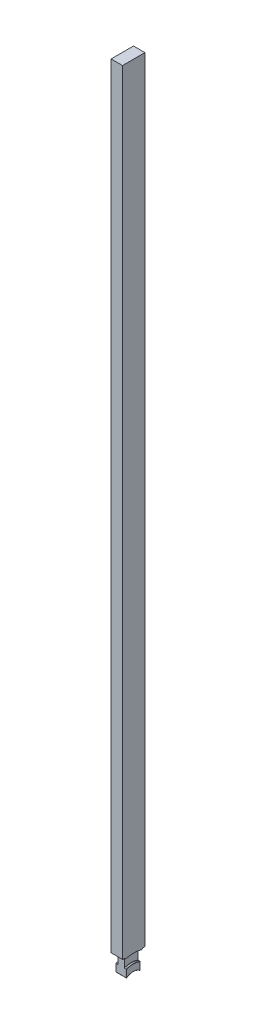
SolidWorks part; units mm, degrees
other "<4-48 DETENT>-<Imported1>"
other "<4-48 DETENT>-<Imported2>"
ref_plane "Front Plane" through (0, 0, 0) normal (0, 0, 1) x (1, 0, 0)
ref_plane "Top Plane" through (0, 0, 0) normal (0, 1, 0) x (1, 0, 0)
ref_plane "Right Plane" through (0, 0, 0) normal (1, 0, 0) x (0, 0, -1)
sketch "Sketch1" plane through (0, 0, 0) normal (1, 0, 0) x (0, 0, -1)
  line L0 (-6.477, 463.55) -> (-6.477, 0)
  line L1 (0, 249.2329) -> (0, 0) construction
  line L2 (6.477, 463.55) -> (6.477, 0)
  line L3 (-6.477, 463.55) -> (6.477, 463.55)
  line L4 (-6.477, 0) -> (6.477, 0)
  circle A1 centre (0, 0) radius 6.35 construction
  point P5 (0, 5.969)
  dimension "D1" = 6.35
  dimension "D2" = 457.2
  dimension "D3" = 12.954
  dimension "D4" = 0.381
extrude "Boss-Extrude1" add sketch "Sketch1" along normal mid plane 6.604
sketch "Sketch2" plane through (0, 0, 0) normal (0, 0, 1) x (1, 0, 0)
  line L0 (3.302, 10.3124) -> (1.905, 10.3124)
  line L1 (3.302, 463.55) -> (3.302, 0) construction
  line L2 (1.905, 10.3124) -> (1.905, 15.875)
  line L3 (1.905, 15.875) -> (3.302, 15.875)
  line L4 (3.302, 15.875) -> (3.302, 10.3124)
  line L5 (0, 29.9173) -> (0, 0) construction
  line L6 (-3.302, 15.875) -> (-3.302, 10.3124)
  line L7 (-1.905, 15.875) -> (-3.302, 15.875)
  line L8 (-1.905, 10.3124) -> (-1.905, 15.875)
  line L9 (-3.302, 10.3124) -> (-1.905, 10.3124)
  line L10 (-8.8482, 0) -> (24.5305, 0) construction
  dimension "D1" = 3.81
  dimension "D2" = 15.875
  dimension "D3" = 10.3124
revolve "Cut-Revolve1" cut sketch "Sketch2" angle 360 about L10
sketch "Sketch6" plane through (0, 0, 0) normal (1, 0, 0) x (0, 0, -1)
  line L0 (0, 19.903) -> (0, 3.2785) construction
  line L1 (3.9624, 0) -> (19.2024, 0)
  line L2 (3.9624, 0) -> (3.9624, 13.589)
  line L3 (6.2484, 15.875) -> (19.2024, 15.875)
  line L4 (19.2024, 0) -> (19.2024, 15.875)
  line L9 (-3.9624, 0) -> (-19.2024, 0)
  line L10 (-19.2024, 0) -> (-19.2024, 15.875)
  line L11 (-6.2484, 15.875) -> (-19.2024, 15.875)
  line L12 (-3.9624, 0) -> (-3.9624, 13.589)
  line L13 (-6.477, 0) -> (6.477, 0) construction
  line L14 (-6.477, 22.1375) -> (-6.477, 15.875) construction
  line L15 (-6.477, 463.55) -> (-6.477, 14.4936) construction
  arc A0 (3.9624, 13.589) -> (6.2484, 15.875) centre (6.2484, 13.589) cw
  arc A1 (-3.9624, 13.589) -> (-6.2484, 15.875) centre (-6.2484, 13.589) ccw
  dimension "D3" = 2.286
  dimension "D1" = 7.9248
  dimension "D2" = 15.24
  dimension "D4" = 15.875
extrude "Cut-Extrude2" cut sketch "Sketch6" against normal through all both and the other way through all
sketch "Sketch7" plane through (0, 0, 0) normal (1, 0, 0) x (0, 0, -1)
  circle A0 centre (0, 0) radius 6.35
  dimension "D1" = 6.35
extrude "Cut-Extrude3" cut sketch "Sketch7" against normal through all both and the other way through all
sketch "Sketch8" plane through (0, 0, 0) normal (0, 0, 1) x (1, 0, 0)
  line L1 (-3.302, 10.3124) -> (-3.048, 10.3124)
  line L2 (-3.302, 10.3124) -> (-3.302, 4.962)
  line L3 (-3.302, 4.962) -> (-3.048, 4.962)
  line L4 (-3.048, 10.3124) -> (-3.048, 4.962)
  line L5 (0, 18.3159) -> (0, 0) construction
  line L6 (3.048, 10.3124) -> (3.048, 4.962)
  line L7 (3.302, 4.962) -> (3.048, 4.962)
  line L8 (3.302, 10.3124) -> (3.302, 4.962)
  line L9 (3.302, 10.3124) -> (3.048, 10.3124)
  line L10 (-3.302, 4.962) -> (3.302, 4.962) construction
  dimension "D1" = 6.096
extrude "Cut-Extrude4" cut sketch "Sketch8" against normal through all both and the other way through all
fillet "Fillet1" radius 0.762 2 edges at (-1.905, 15.875, 0) (1.905, 15.875, 0)
fillet "Fillet2" radius 0.127 2 edges at (-1.905, 10.3124, 0) (1.905, 10.3124, 0)
hole_wizard "#4-48 Tapped Hole1" positions "Sketch3" profile "Sketch4" tap size "#4-48" standard "ANSI Inch"
sketch "Sketch3" plane through (0, 0, 0) normal (0, 1, 0) x (1, 0, 0)
  point P0 (0, 0)
sketch "Sketch4" plane through (0, 0, 0) normal (1, 0, 0) x (0, 0, -1)
  line L0 (0, 0) -> (0, 13.9215)
  line L1 (0, 13.9215) -> (1.1874, 13.208)
  line L2 (1.1874, 13.208) -> (1.1874, 0)
  line L5 (1.1874, 0) -> (0, 0)
  line L10 (0, 13.9215) -> (-1.1875, 13.208) construction
  line L11 (0, -6.35) -> (0, 107.95) construction
  dimension "Tap Drill Dia." = 2.3749
  dimension "Tap Drill Depth" = 13.208
  dimension "Drill Angle" = 118
fillet "Fillet3" radius 0.127 10 edges at (0, 4.962, -3.9624) (-3.048, 6.35, 0) (3.048, 6.35, 0) (0, 4.962, 3.9624) (-3.048, 7.2414, 3.9624) (-3.048, 10.3124, 0) (-3.048, 7.2414, -3.9624) (3.048, 7.2414, -3.9624) (3.048, 10.3124, 0) (3.048, 7.2414, 3.9624)
ref_plane "Plane1" through (0, 5.969, 0) normal (0, 1, 0) x (1, 0, 0)
inserted part "4-48 DETENT"
move or copy body "Body-Move/Copy2" placed by mates yes
